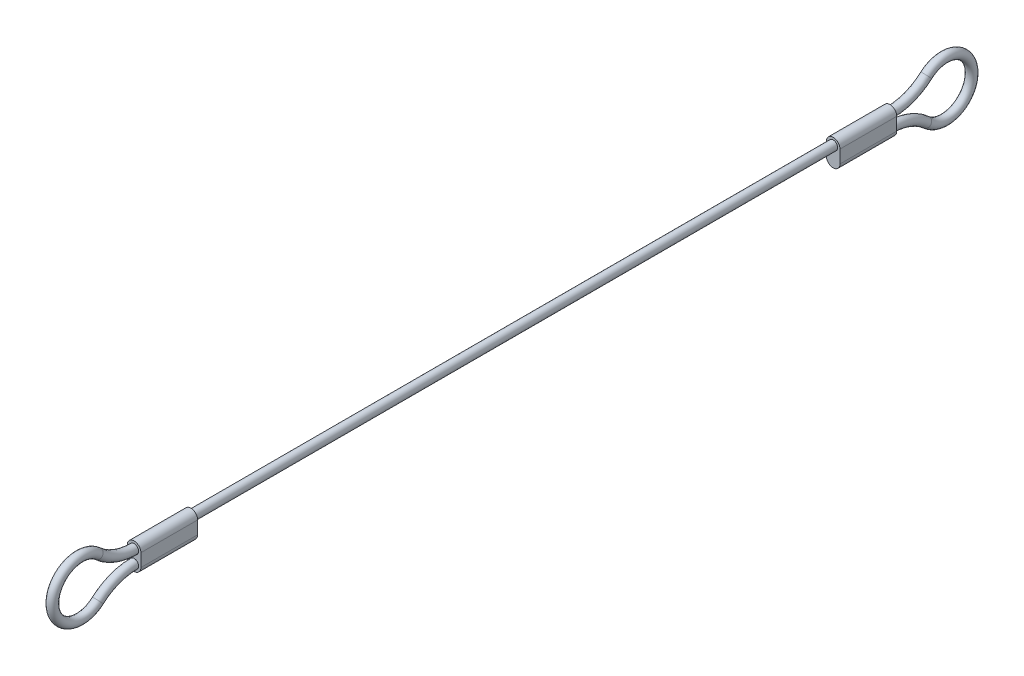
SolidWorks part; units mm, degrees
ref_plane "Front Plane" through (0, 0, 0) normal (0, 0, 1) x (1, 0, 0)
ref_plane "Top Plane" through (0, 0, 0) normal (0, 1, 0) x (1, 0, 0)
ref_plane "Right Plane" through (0, 0, 0) normal (1, 0, 0) x (0, 0, -1)
sketch "Sketch1" plane through (0, 0, 0) normal (1, 0, 0) x (0, 0, -1)
  line L0 (66.6, 0) -> (-66.6, 0)
  line L1 (0, 1.32) -> (0, -1.32) construction
  arc A0 (-66.6, 0) -> (-73, 2.4446) centre (-66.6, 9.6) cw
  arc A1 (-73, 2.4446) -> (-73, -4.7108) centre (-76.2, -1.1331) ccw
  arc A2 (-73, -4.7108) -> (-66.6, -2.2663) centre (-66.6, -11.8663) cw
  arc A3 (73, -4.7108) -> (66.6, -2.2663) centre (66.6, -11.8663) ccw
  arc A4 (73, 2.4446) -> (73, -4.7108) centre (76.2, -1.1331) cw
  arc A5 (66.6, 0) -> (73, 2.4446) centre (66.6, 9.6) ccw
  point P18 (0, 0)
  dimension "D1" = 4.8
  dimension "D4" = 9.6
  dimension "D2" = 76.2
  dimension "D3" = 9.6
sketch "Sketch2" plane through (0, 0, 0) normal (0, 0, 1) x (1, 0, 0)
  circle A0 centre (0, 0) radius 0.795
  dimension "D1" = 1.59
sweep "Sweep1" add profiles "Sketch2" path "Sketch1"
sketch "Sketch3" plane through (0, 0, 66.6) normal (0, 0, -1) x (-1, 0, 0)
  line L0 (0, 0) -> (0, -2.2663) construction
  line L1 (1.2, 0) -> (1.2, -2.2663)
  line L2 (-1.2, 0) -> (-1.2, -2.2663)
  line L3 (-0.795, -2.2663) -> (0.795, -2.2663) construction
  arc A0 (1.2, 0) -> (-1.2, 0) centre (0, 0) ccw
  arc A1 (-1.2, -2.2663) -> (1.2, -2.2663) centre (0, -2.2663) ccw
  point P3 (0, -1.1331)
  dimension "D1" = 2.4
extrude "Boss-Extrude1" add sketch "Sketch3" along normal blind 10
mirror "Mirror1" about plane through (0, 0, 0) normal (0, 0, 1) of "Boss-Extrude1"
